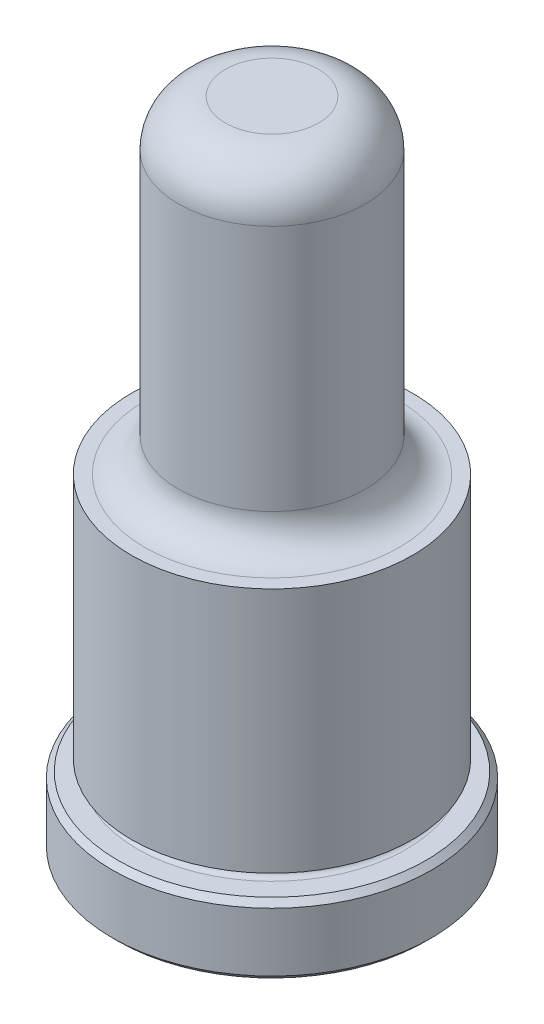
SolidWorks part; units mm, degrees
ref_plane "Front Plane" through (0, 0, 0) normal (0, 0, 1) x (1, 0, 0)
ref_plane "Top Plane" through (0, 0, 0) normal (0, 1, 0) x (1, 0, 0)
ref_plane "Right Plane" through (0, 0, 0) normal (1, 0, 0) x (0, 0, -1)
sketch "Sketch1" plane through (0, 0, 0) normal (1, 0, 0) x (0, 0, -1)
  line L0 (0, 0) -> (10.8331, 0)
  line L1 (10.8331, 0) -> (10.8331, 4.7498)
  line L2 (10.8331, 4.7498) -> (9.1313, 4.7498)
  line L3 (8.7503, 2.6782) -> (8.7503, 5.9795) construction
  line L4 (9.1313, 5.5118) -> (9.5377, 5.5118)
  line L5 (9.5377, 5.5118) -> (9.5377, 22.225)
  line L6 (9.5377, 22.225) -> (8.6233, 22.225)
  line L7 (6.3373, 24.511) -> (6.3373, 44.45)
  line L9 (6.3373, 44.45) -> (0, 44.45)
  line L10 (0, 44.45) -> (0, 0)
  line L11 (0, 0) -> (0, -7.2694) construction
  arc A0 (9.1313, 5.5118) -> (9.1313, 4.7498) centre (9.1313, 5.1308) ccw
  arc A1 (8.6233, 22.225) -> (6.3373, 24.511) centre (8.6233, 24.511) cw
  point P2 (6.3373, 44.45)
  point P14 (6.4512, 44.45)
  point P19 (6.3373, 22.225)
  dimension "D14" = 0.762
  dimension "D8" = 2.286
  dimension "T" = 4.7498
  dimension "D2" = 0.762
  dimension "M" = 21.6662
  dimension "B" = 19.0754
  dimension "L" = 44.45
  dimension "D7" = 0.7874
  dimension "A" = 22.225
  dimension "D" = 12.6746
  dimension "D15" = 22.225
revolve "Revolve1" add sketch "Sketch1" angle 360 about L11
fillet "Fillet6" radius 3.175 1 edges at (0, 44.45, 6.3373)
chamfer "Chamfer1" distance 0.381 angle 45 2 edges at (0, 0, 10.8331) (0, 4.7498, 10.8331)
